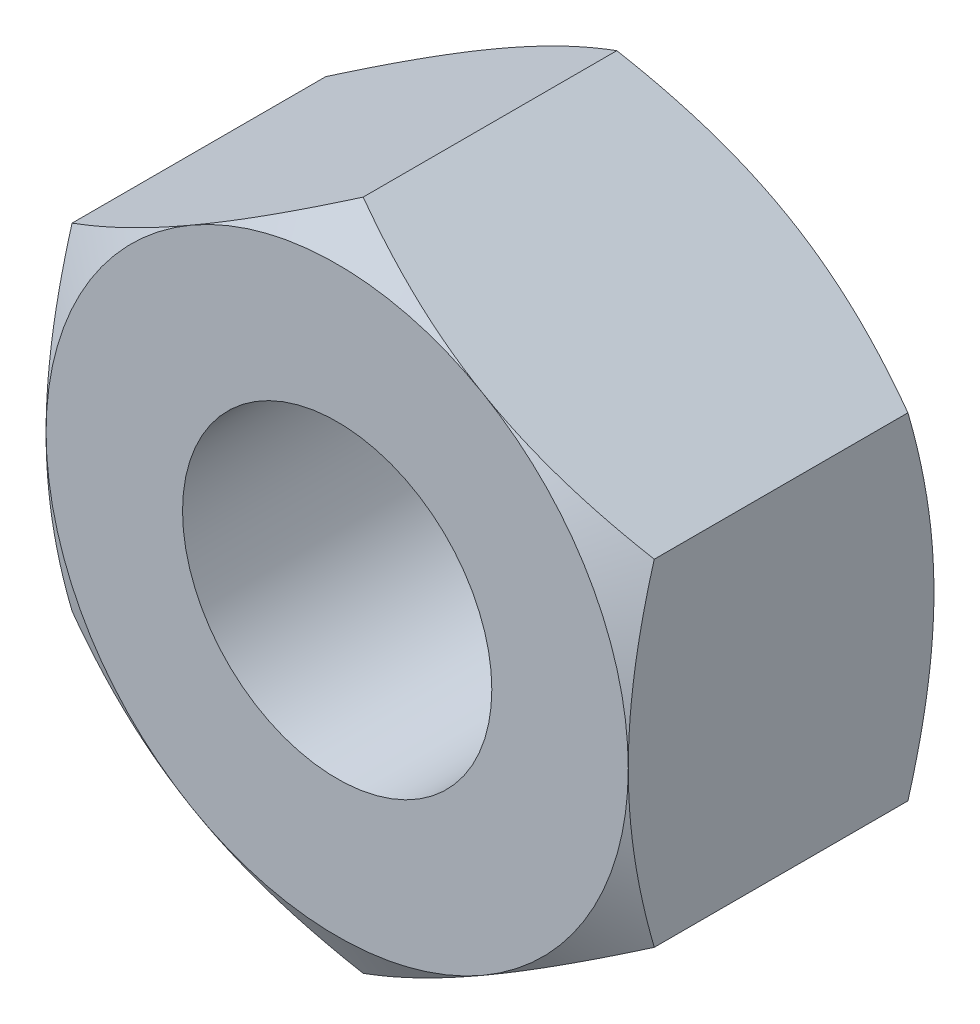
SolidWorks part; units mm, degrees
ref_plane "Face" through (0, 0, 0) normal (0, 0, 1) x (1, 0, 0)
ref_plane "Coté" through (0, 0, 0) normal (0, 1, 0) x (1, 0, 0)
ref_plane "Dessus" through (0, 0, 0) normal (1, 0, 0) x (0, 0, -1)
sketch "Esquisse1" plane through (0, 0, 0) normal (0, 0, 1) x (1, 0, 0)
  line L1 (8, 4.6188) -> (0, 9.2376)
  line L2 (0, 9.2376) -> (-8, 4.6188)
  line L3 (-8, 4.6188) -> (-8, -4.6188)
  line L4 (-8, -4.6188) -> (0, -9.2376)
  line L5 (0, -9.2376) -> (8, -4.6188)
  line L6 (8, -4.6188) -> (8, 4.6188)
  circle A0 centre (0, 0) radius 8 construction
  dimension "D1" = 16
extrude "Base-Extrusion" add sketch "Esquisse1" along normal blind 8.4
sketch "Esquisse4" plane through (0, 0, 0) normal (1, 0, 0) x (0, 0, -1)
  line L0 (-0.7145, 9.2376) -> (0, 9.2376)
  line L1 (-8.4, 9.2376) -> (0, 9.2376) construction
  line L2 (0, 9.2376) -> (0, 8)
  line L3 (0, 8) -> (-0.7145, 9.2376)
  line L4 (2.7645, 0) -> (-11.5815, 0) construction
  line L5 (-8.4, 9.2376) -> (-7.6855, 9.2376)
  line L6 (-7.6855, 9.2376) -> (-8.4, 8)
  line L7 (-8.4, 4.6188) -> (-8.4, 9.2376) construction
  line L8 (-8.4, 8) -> (-8.4, 9.2376)
  dimension "D1" = 16
  dimension "D2" = 30
revolve "Enlèvement de matière-Révolution1" cut sketch "Esquisse4" angle 360 about L4
hole_wizard "Trou taraudé M10x1.51" positions "Esquisse3D1" profile "Esquisse5" tap size "M10x1.5" standard "ISO"
sketch3d "Esquisse3D1"
  point P0 (0, 0, 0)
sketch "Esquisse5" plane through (0, 0, 0) normal (1, 0, 0) x (0, 1, 0)
  line L0 (0, 0) -> (0, 8.4)
  line L1 (0, 8.4) -> (4.25, 8.4)
  line L2 (4.25, 8.4) -> (4.25, 0)
  line L5 (4.25, 0) -> (0, 0)
  line L11 (0, -6.35) -> (0, 107.95) construction
  dimension "Diamètre du perçage jusqu'au prochain" = 8.5
  dimension "Profondeur du perçage jusqu'au prochain" = 8.4
